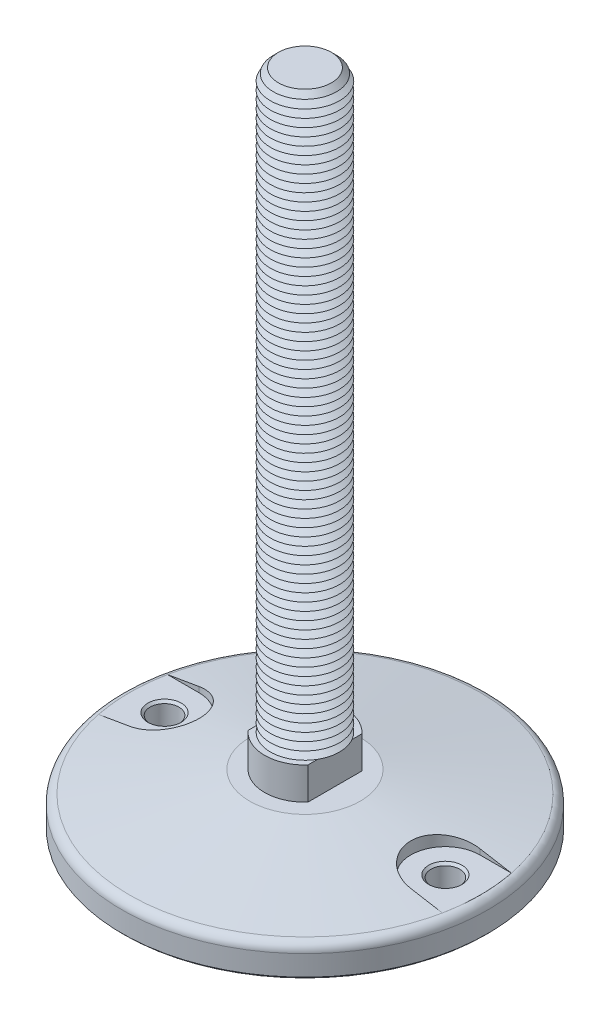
SolidWorks part; units mm, degrees
ref_plane "Front Plane" through (0, 0, 0) normal (0, 0, 1) x (1, 0, 0)
ref_plane "Top Plane" through (0, 0, 0) normal (0, 1, 0) x (1, 0, 0)
ref_plane "Right Plane" through (0, 0, 0) normal (1, 0, 0) x (0, 0, -1)
sketch "Sketch1" plane through (0, 0, 0) normal (1, 0, 0) x (0, 0, -1)
  line L0 (0, 61.3389) -> (0, -58.404) construction
sketch "Sketch2" plane through (0, 0, 0) normal (1, 0, 0) x (0, 0, -1)
  line L0 (0, 0) -> (-24, 0)
  line L1 (-24, 0) -> (-79.5, -9.7861)
  line L2 (-79.5, -9.7861) -> (-79.5, -23)
  line L3 (-79.5, -23) -> (0, -23)
  line L4 (0, 61.3389) -> (0, -58.404) construction
  line L5 (0, -23) -> (0, 0)
  dimension "D1" = 23
  dimension "D2" = 79.5
  dimension "D3" = 24
  dimension "D4" = 10
revolve "Revolve1" add sketch "Sketch2" angle 360 about L0
fillet "Fillet1" radius 4 1 edges at (0, -9.7861, 79.5)
sketch "Sketch3" plane through (0, 0, 0) normal (0, 1, 0) x (1, 0, 0)
  circle A0 centre (0, 0) radius 17.5
  dimension "D1" = 35
extrude "Boss-Extrude1" add sketch "Sketch3" along normal blind 14
sketch "Sketch4" plane through (0, 14, 0) normal (0, 1, 0) x (1, 0, 0)
  line L0 (-13, 11.7154) -> (-13, -11.7154)
  line L2 (13, -11.7154) -> (13, 11.7154)
  arc A0 (-13, 11.7154) -> (-13, -11.7154) centre (0, 0) ccw
  circle A1 centre (0, 0) radius 17.5 construction
  arc A2 (13, -11.7154) -> (13, 11.7154) centre (0, 0) ccw
  dimension "D1" = 26
extrude "Cut-Extrude1" cut sketch "Sketch4" against normal blind 14
sketch "Sketch5" plane through (0, 14, 0) normal (0, 1, 0) x (1, 0, 0)
  circle A0 centre (0, 0) radius 15
  dimension "D1" = 30
extrude "Boss-Extrude2" add sketch "Sketch5" along normal blind 250
chamfer "Chamfer1" distance 3.5 angle 45 1 edges at (0, 264, 15)
sketch "Sketch6" plane through (0, 0, 0) normal (1, 0, 0) x (0, 0, -1)
  line L0 (-15, 14) -> (-11.9689, 15.75)
  line L1 (-11.9689, 15.75) -> (-15, 17.5)
  line L2 (-15, 260.5) -> (-15, 14) construction
  line L3 (-15, 17.5) -> (-15, 14)
  dimension "D1" = 3.5
revolve "Cut-Revolve1" cut sketch "Sketch6" angle 360 about L0
pattern_linear "LPattern1" count 71 spacing 3.5 along (0, 1, 0) of "Cut-Revolve1"
sketch "Sketch8" plane through (0, 0, 0) normal (0, 1, 0) x (1, 0, 0)
  line L0 (-61, 15) -> (-74.7035, 15)
  line L1 (-61, -15) -> (-74.7035, -15)
  arc A1 (-74.7035, 15) -> (-74.7035, -15) centre (0, 0) ccw
  circle A2 centre (0, 0) radius 76.1946 construction
  arc A3 (-61, -15) -> (-61, 15) centre (-61, 0) ccw
  point P3 (-61, 0)
  point P11 (0, 0)
  dimension "D1" = 61
  dimension "D2" = 30
extrude "Cut-Extrude4" cut sketch "Sketch8" against normal blind 9.2
sketch "Sketch10" plane through (0, -9.2, 0) normal (0, 1, 0) x (1, 0, 0)
  circle A0 centre (-61, 0) radius 6.25
  dimension "D1" = 12.5
extrude "Cut-Extrude5" cut sketch "Sketch10" against normal up to surface (13.8 mm away)
chamfer "Chamfer2" distance 1 angle 45 2 edges at (-61, -23, -6.25) (-61, -9.2, 6.25)
mirror "Mirror1" about plane through (0, 0, 0) normal (1, 0, 0) of "Chamfer2", "Cut-Extrude5", "Cut-Extrude4"
chamfer "Chamfer3" distance 1 angle 45 1 edges at (0, -23, 79.5)
